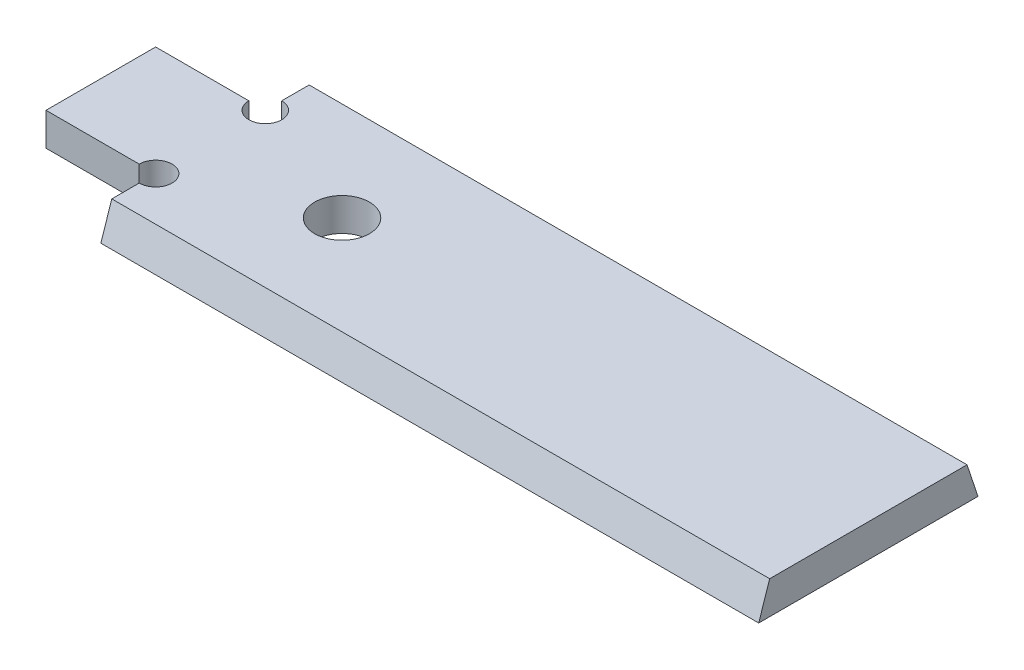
SolidWorks part; units mm, degrees
ref_plane "Front" through (0, 0, 0) normal (0, 0, 1) x (1, 0, 0)
ref_plane "Top" through (0, 0, 0) normal (0, 1, 0) x (1, 0, 0)
ref_plane "Right" through (0, 0, 0) normal (1, 0, 0) x (0, 0, -1)
sketch "Sketch1" plane through (0, 0, 0) normal (0, 1, 0) x (1, 0, 0)
  line L0 (10, 0) -> (10, 3.5)
  line L1 (10, 0) -> (70, 0)
  line L2 (0, 5) -> (0, 15)
  line L3 (10, 20) -> (70, 20)
  line L4 (70, 0) -> (70, 20)
  line L5 (0, 0) -> (0, 20) construction
  line L6 (0, 5) -> (8.5, 5)
  line L7 (0, 15) -> (8.5, 15)
  line L10 (10, 0) -> (10, 20) construction
  line L11 (10, 16.5) -> (10, 20)
  circle A0 centre (22, 10) radius 2.5
  arc A1 (8.5, 15) -> (10, 16.5) centre (10, 15) ccw
  arc A2 (10, 3.5) -> (8.5, 5) centre (10, 5) ccw
extrude "Extrude1" add sketch "Sketch1" along normal blind 3
sketch "Sketch2" plane through (70, 0, 0) normal (1, 0, 0) x (0, 0, -1)
  line L0 (0, 0) -> (0, 3)
  line L1 (0, 3) -> (1, 3)
  line L2 (0, 3) -> (20, 3) construction
  line L3 (1, 3) -> (0, 0)
  line L4 (20, 0) -> (20, 3)
  line L5 (20, 3) -> (19, 3)
  line L6 (19, 3) -> (20, 0)
extrude "Cut-Extrude1" cut sketch "Sketch2" against normal through all
